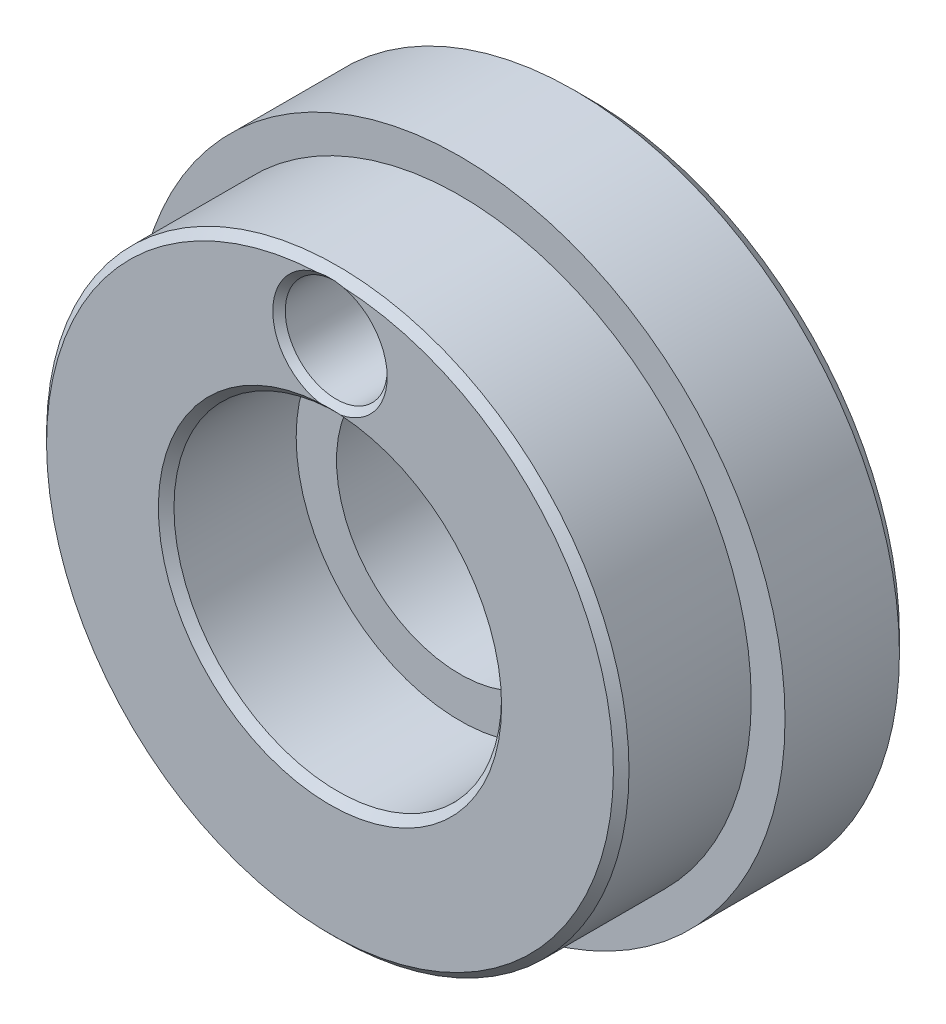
SolidWorks part; units mm, degrees
ref_plane "Front Plane" through (0, 0, 0) normal (0, 0, 1) x (1, 0, 0)
ref_plane "Top Plane" through (0, 0, 0) normal (0, 1, 0) x (1, 0, 0)
ref_plane "Right Plane" through (0, 0, 0) normal (1, 0, 0) x (0, 0, -1)
sketch "Sketch1" plane through (0, 0, 0) normal (0, 0, 1) x (1, 0, 0)
  circle A0 centre (0, 0) radius 15.875
  dimension "D1" = 31.75
extrude "rod stock" add sketch "Sketch1" along normal blind 12.7
sketch "Sketch2" plane through (0, 0, 12.7) normal (0, 0, 1) x (1, 0, 0)
  circle A0 centre (0, 0) radius 15.875
  circle A1 centre (0, 0) radius 14.224
  circle A2 centre (0, 0) radius 15.875 construction
  dimension "D1" = 1.651
extrude "tube end" cut sketch "Sketch2" against normal blind 6.35
sketch "Sketch3" plane through (0, 0, 12.7) normal (0, 0, 1) x (1, 0, 0)
  circle A0 centre (0, 0) radius 8.001
  dimension "D1" = 16.002
extrude "sensor body hole" cut sketch "Sketch3" against normal blind 6.35
sketch "Sketch4" plane through (0, 0, 6.35) normal (0, 0, 1) x (1, 0, 0)
  circle A0 centre (0, 0) radius 6.0325
  dimension "D1" = 12.065
extrude "sensor tube thru hole" cut sketch "Sketch4" against normal through all
chamfer "Chamfer1" distance 0.762 angle 45 1 edges at (15.875, 0, 0)
hole_wizard "#9 (0.196) Diameter Hole1" positions "Sketch7" profile "Sketch6" hole size "#9" standard "ANSI Inch"
sketch "Sketch7" plane through (0, 0, 12.7) normal (0, 0, 1) x (1, 0, 0)
  line L0 (0, 0) -> (0, 16.4729) construction
  point P0 (0, 11.1125)
  dimension "D1" = 11.1125
sketch "Sketch6" plane through (0, 11.1125, 12.7) normal (1, 0, 0) x (0, -1, 0)
  line L0 (0, 0) -> (0, 10.3857)
  line L1 (0, 10.3857) -> (2.4892, 8.89)
  line L2 (2.4892, 8.89) -> (2.4892, 0.3048)
  line L3 (2.4892, 0.3048) -> (2.794, 0)
  line L5 (2.794, 0) -> (0, 0)
  line L6 (-2.4892, 0.3048) -> (-2.794, 0) construction
  line L10 (0, 10.3857) -> (-2.4892, 8.89) construction
  line L11 (0, -6.35) -> (0, 107.95) construction
  dimension "Hole Dia." = 4.9784
  dimension "Hole Depth" = 8.89
  dimension "Near C'Sink Dia." = 5.588
  dimension "Near C'Sink Angle" = 90
  dimension "Drill Angle" = 118
chamfer "Chamfer2" distance 0.381 angle 45 2 edges at (14.224, 0, 12.7) (8.001, 0, 12.7)
